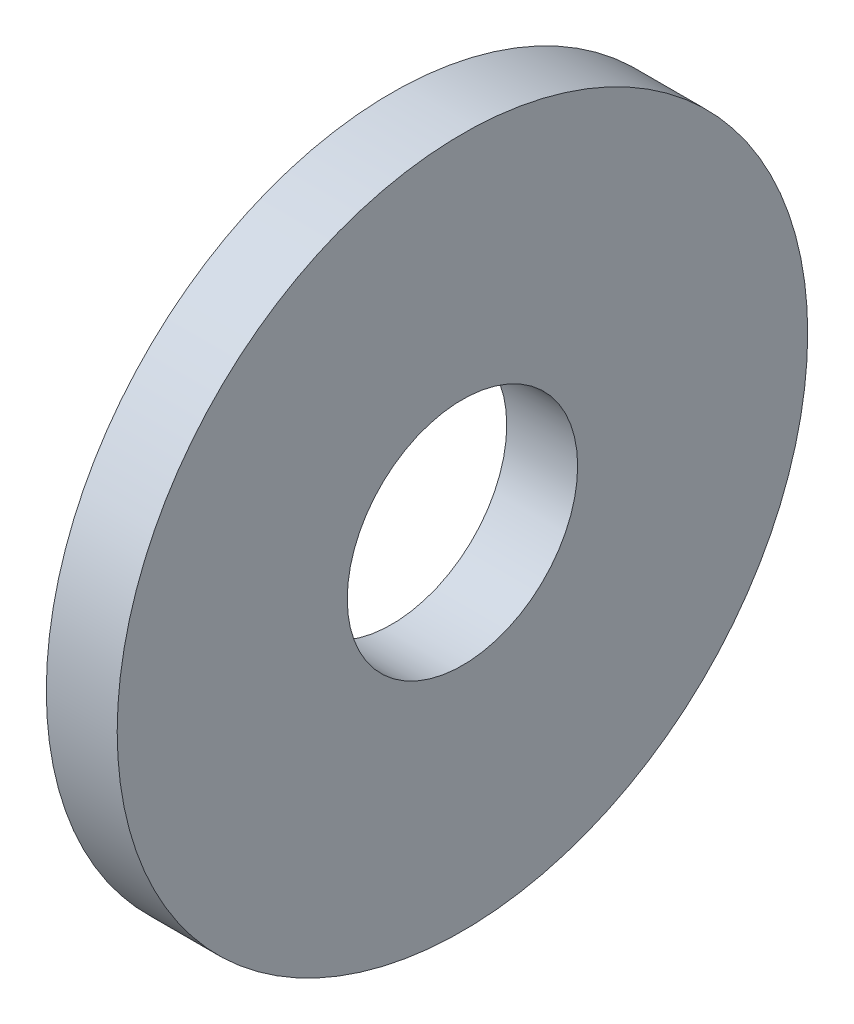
SolidWorks part; units mm, degrees
ref_plane "Plano frontal" through (0, 0, 0) normal (0, 0, 1) x (1, 0, 0)
ref_plane "Plano superior" through (0, 0, 0) normal (0, 1, 0) x (1, 0, 0)
ref_plane "Plano direito" through (0, 0, 0) normal (1, 0, 0) x (0, 0, -1)
sketch "Esboço1" plane through (0, 0, 0) normal (1, 0, 0) x (0, 0, -1)
  circle A0 centre (0, 0) radius 9.74
  circle A1 centre (0, 0) radius 3.25
  dimension "D1" = 19.48
  dimension "D2" = 6.5
extrude "Ressalto-extrusão1" add sketch "Esboço1" along normal blind 2
